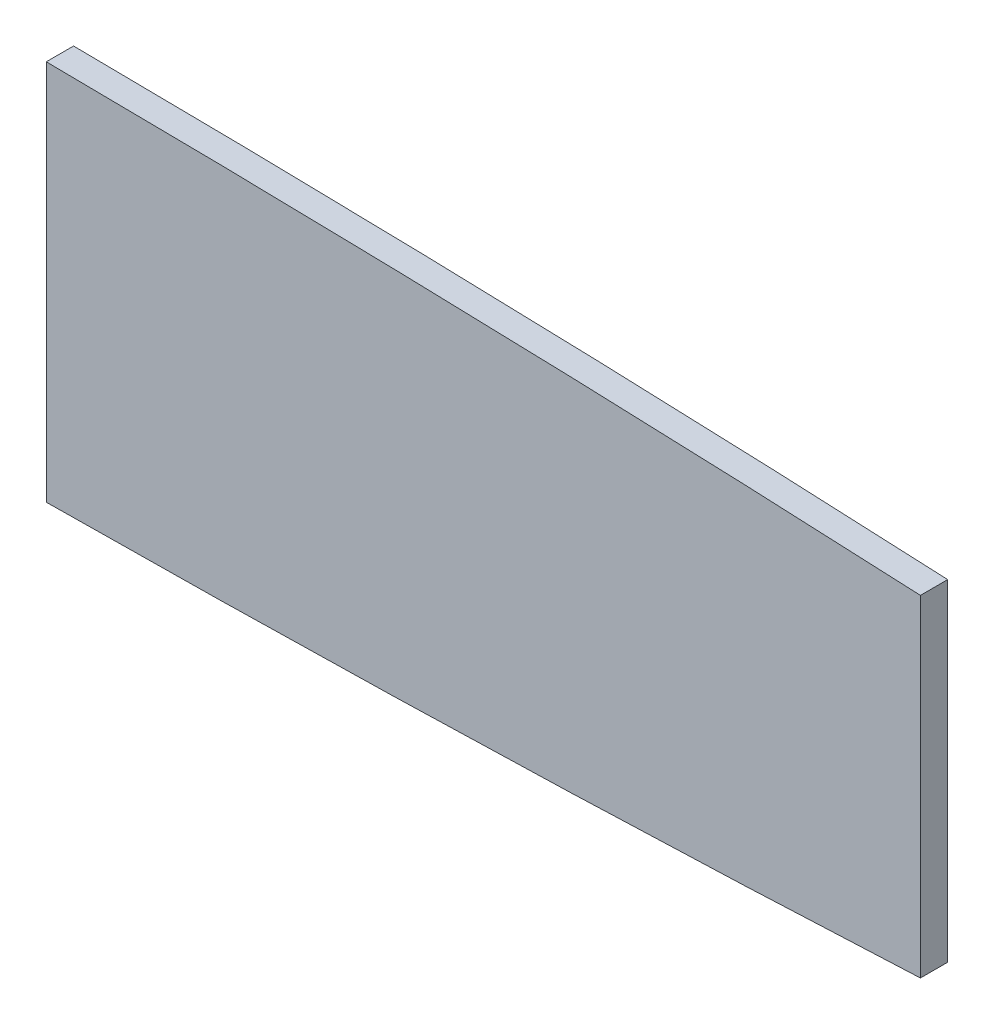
SolidWorks part; units mm, degrees
ref_plane "Front Plane" through (0, 0, 0) normal (0, 0, 1) x (1, 0, 0)
ref_plane "Top Plane" through (0, 0, 0) normal (0, 1, 0) x (1, 0, 0)
ref_plane "Right Plane" through (0, 0, 0) normal (1, 0, 0) x (0, 0, -1)
sketch "Sketch1" plane through (0, 0, 0) normal (0, 0, 1) x (1, 0, 0)
  line L0 (159.9965, -60.6534) -> (159.9965, 60.6534)
  line L1 (-159.9965, 69.8209) -> (-159.9965, -69.8209)
  arc A0 (62.7518, 64.8446) -> (-159.9965, 69.8209) centre (-221.019, -7649.477) ccw
  arc A1 (-159.9965, -69.8209) -> (62.7518, -64.8446) centre (-221.019, 7649.477) ccw
  arc A2 (62.7518, -64.8446) -> (159.9965, -60.6534) centre (-221.019, 7649.477) ccw
  arc A3 (159.9965, 60.6534) -> (62.7518, 64.8446) centre (-221.019, -7649.477) ccw
extrude "Boss-Extrude1" add sketch "Sketch1" along normal blind 10
